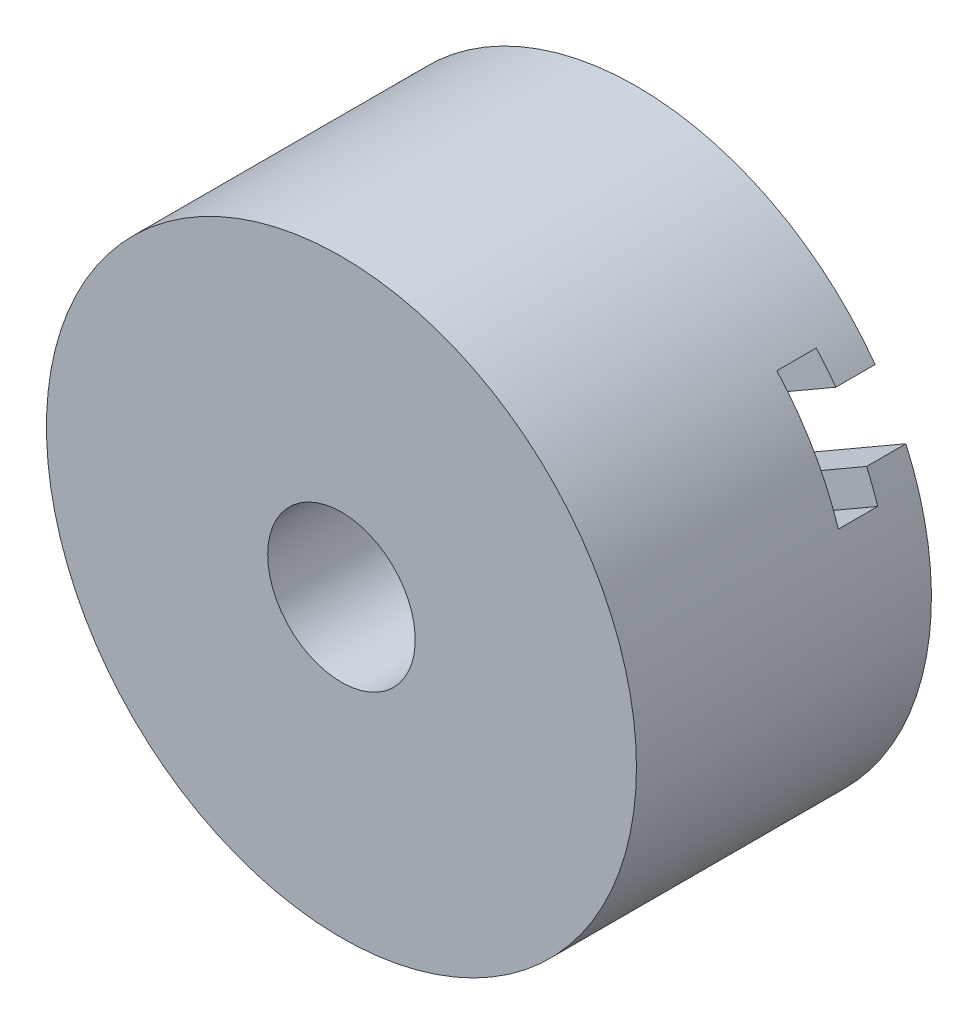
SolidWorks part; units mm, degrees
ref_plane "Face" through (0, 0, 0) normal (0, 0, 1) x (1, 0, 0)
ref_plane "Dessus" through (0, 0, 0) normal (0, 1, 0) x (1, 0, 0)
ref_plane "Droite" through (0, 0, 0) normal (1, 0, 0) x (0, 0, -1)
sketch "Esquisse1" plane through (0, 0, 0) normal (0, 0, 1) x (1, 0, 0)
  circle A0 centre (0, 0) radius 120
  dimension "D1" = 240
extrude "Boss.-Extru.1" add sketch "Esquisse1" along normal blind 120
sketch "Esquisse4" plane through (0, 0, 0) normal (0, 0, -1) x (-1, 0, 0)
  circle A0 centre (0, 0) radius 30
  dimension "D1" = 60
extrude "Enlèv. mat.-Extru.2" cut sketch "Esquisse4" against normal through all
sketch "Esquisse3" plane through (0, 0, 0) normal (0, 1, 0) x (1, 0, 0)
  line L0 (-12.5, 0) -> (12.5, 0)
  line L1 (12.5, 0) -> (12.5, -16)
  line L2 (12.5, -16) -> (25, -16)
  line L3 (25, -16) -> (25, -32)
  line L4 (25, -32) -> (-25, -32)
  line L5 (120, 0) -> (-120, 0) construction
  line L6 (-25, -16) -> (-25, -32)
  line L7 (-12.5, -16) -> (-25, -16)
  line L8 (0, 0) -> (0, 31.7681) construction
  line L9 (-12.5, 0) -> (-12.5, -16)
  point P12 (0, -32)
  point P15 (0, 0)
  dimension "D1" = 25
  dimension "D2" = 50
  dimension "D3" = 16
  dimension "D4" = 32
extrude "Enlèv. mat.-Extru.1" cut sketch "Esquisse3" against normal through all
pattern_circular "Répétition circulaire1" count 3 over 360 about axis through (0, 0, 0) along (0, 0, 1) of "Enlèv. mat.-Extru.1"
